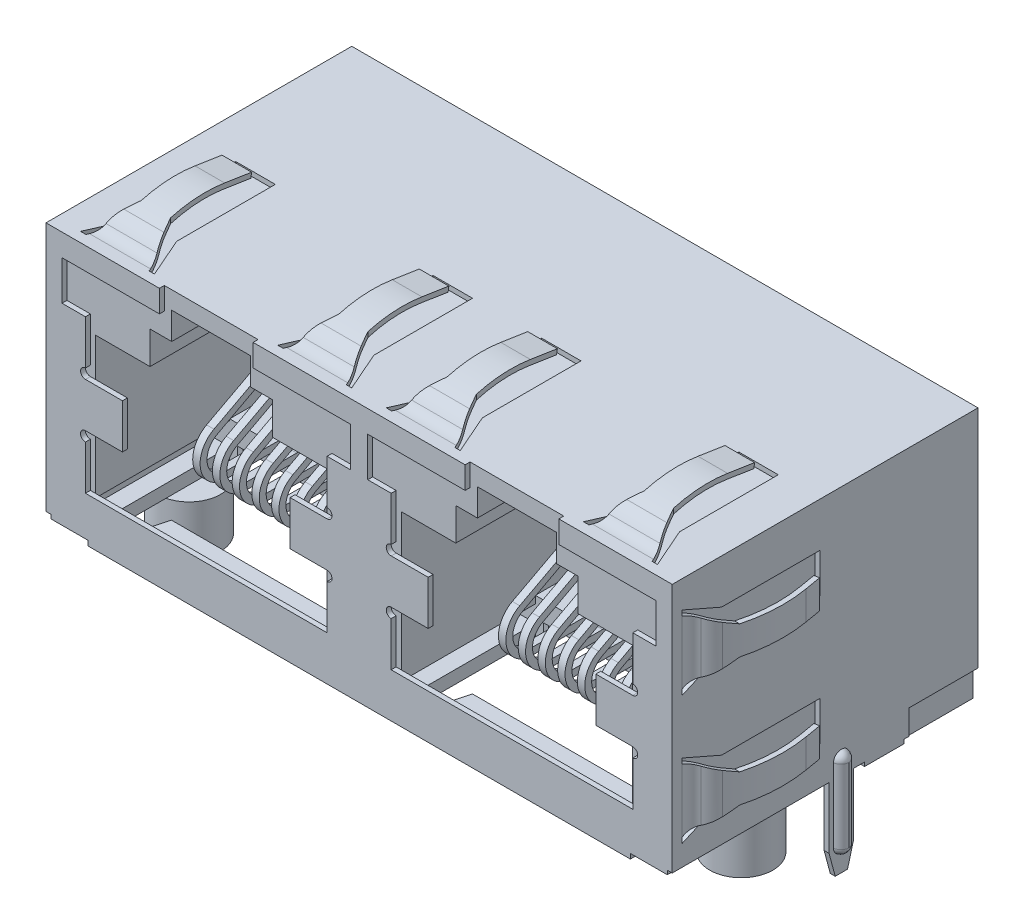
SolidWorks part; units mm, degrees
ref_plane "Front Plane" through (0, 0, 0) normal (0, 0, 1) x (1, 0, 0)
ref_plane "Top Plane" through (0, 0, 0) normal (0, 1, 0) x (1, 0, 0)
ref_plane "Right Plane" through (0, 0, 0) normal (1, 0, 0) x (0, 0, -1)
imported_body "Imported1"
sketch "Sketch2" plane through (0, 0.254, 0) normal (0, -1, 0) x (1, 0, 0)
  line L1 (-15.6895, -2.5396) -> (-13.6183, -2.5396)
  line L2 (-15.6895, -2.5396) -> (-15.6895, -7.476)
  line L3 (-15.6895, -7.476) -> (-13.6183, -7.476)
  line L4 (-13.6183, -2.5396) -> (-13.6183, -7.476)
  line L5 (15.6904, -2.9411) -> (13.639, -2.9411)
  line L6 (15.6904, -2.9411) -> (15.6904, -7.476)
  line L7 (15.6904, -7.476) -> (13.639, -7.476)
  line L8 (13.639, -2.9411) -> (13.639, -7.476)
extrude "Cut-Extrude1" cut sketch "Sketch2" along normal through all
sketch "Sketch3" plane through (0, 1.143, 0) normal (0, -1, 0) x (1, 0, 0)
  line L0 (-13.4239, -7.1628) -> (-2.3241, -7.1628) construction
  line L1 (-12.7201, -12.3883) -> (-2.8171, -12.3883)
  line L2 (-12.7201, -12.3883) -> (-12.7201, -7.1628)
  line L3 (-12.7201, -7.1628) -> (-2.8171, -7.1628)
  line L4 (-2.8171, -12.3883) -> (-2.8171, -7.1628)
  line L5 (13.4239, -7.1628) -> (2.3241, -7.1628) construction
  line L6 (3.2299, -12.0378) -> (12.4756, -12.0378)
  line L7 (3.2299, -12.0378) -> (3.2299, -7.1628)
  line L8 (3.2299, -7.1628) -> (12.4756, -7.1628)
  line L9 (12.4756, -12.0378) -> (12.4756, -7.1628)
extrude "Cut-Extrude2" cut sketch "Sketch3" along normal through all
sketch "Sketch1" plane through (0, 0.254, 0) normal (0, -1, 0) x (1, 0, 0)
  line L0 (0, 0) -> (0, -20.8891) construction
  line L1 (-13.97, 0) -> (13.97, 0) construction
  circle A0 centre (-14.225, -5.46) radius 1.625
  circle A1 centre (14.225, -5.46) radius 1.625
  dimension "D1" = 3.25
  dimension "D2" = 3.25
  dimension "D4" = 28.45
  dimension "D3" = 5.46
extrude "Boss-Extrude1" add sketch "Sketch1" along normal blind 2.54
sketch "Sketch4" plane through (0, 0.254, 0) normal (0, -1, 0) x (1, 0, 0)
  line L1 (-14.9548, -1.3022) -> (15.4552, -1.3022)
  line L2 (-14.9548, -1.3022) -> (-14.9548, -1.609)
  line L3 (-14.9548, -1.609) -> (15.4552, -1.609)
  line L4 (15.4552, -1.3022) -> (15.4552, -1.609)
extrude "Boss-Extrude2" add sketch "Sketch4" along normal blind 0.38
